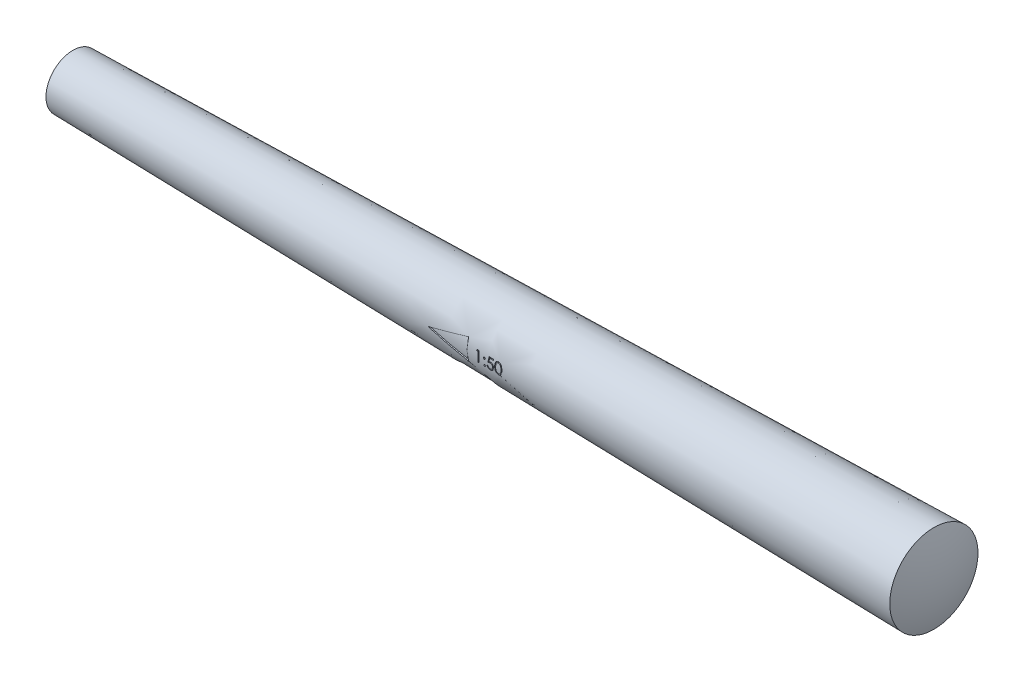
SolidWorks part; units mm, degrees
ref_plane "Front Plane" through (0, 0, 0) normal (0, 0, 1) x (1, 0, 0)
ref_plane "Top Plane" through (0, 0, 0) normal (0, 1, 0) x (1, 0, 0)
ref_plane "Right Plane" through (0, 0, 0) normal (1, 0, 0) x (0, 0, -1)
sketch "Sketch1" plane through (0, 0, 0) normal (1, 0, 0) x (0, 0, -1)
  circle A0 centre (0, 0) radius 2.5
  dimension "D1" = 5
extrude "Extrude1" add sketch "Sketch1" along normal mid plane 80
draft "Draft1" type of draft neutral plane draft angle 1.146 faces to draft 1 parameters "D1"=1.146
sketch "Sketch2" plane through (0, 0, 0) normal (0, 0, 1) x (1, 0, 0)
  line L0 (-40, 0) -> (-40, 2.5)
  line L1 (-40, 2.5) -> (-40, -2.5) construction
  line L2 (-40, 0) -> (-40.75, 0)
  line L3 (-40.75, 0) -> (-40.75, -3.3) construction
  line L4 (40, 0) -> (40, 4.1001)
  line L5 (40, -4.1001) -> (40, 4.1001) construction
  line L6 (40, 0) -> (40.75, 0)
  line L7 (40.75, 0) -> (40.75, -3.3) construction
  line L8 (-40, -2.5) -> (40, -4.1001) construction
  arc A0 (-40.75, 0) -> (-40, 2.5) centre (-36.2083, 0) cw
  arc A1 (40.75, 0) -> (40, 4.1001) centre (29.168, 0) ccw
  point P14 (0, -3.3)
revolve "Revolve1" add sketch "Sketch2" angle 360 about L2
sketch "Sketch5" plane through (0, 0, 0) normal (0, 0, 1) x (1, 0, 0)
  line L0 (0, 3.3) -> (0, -3.3) construction
  line L1 (40, 4.1001) -> (-40, 2.5) construction
  line L2 (-40, -2.5) -> (40, -4.1001) construction
ref_plane "Plane2" through (0, 0, 0) normal (-0.02, 0, 0.9998) x (0.9998, 0, 0.02)
sketch "Sketch6" plane through (0, 0, 0) normal (-0.02, 0, 0.9998) x (0.9998, 0, 0.02)
  line L0 (0, 0) -> (0, 1)
  line L1 (0, 3.3) -> (0, -3.3) construction
  line L2 (0, 1) -> (-3.7321, 0)
  line L3 (-3.7321, 0) -> (0, -1)
  line L4 (0, -1) -> (0, 0)
  line L5 (0, -0.5) -> (4, -0.5) construction
  text T0 "1:50" font "Century Gothic" height 1
  dimension "D1" = 2
  dimension "D2" = 30
  dimension "D3" = 4
wrap "Wrap2" sketch "Sketch6" wrap type deboss source sketch "Sketch6" thickness 0.1 parameters "D1"=0.1
equation "\"D2@Sketch2\" = \"D1@Sketch2\""
